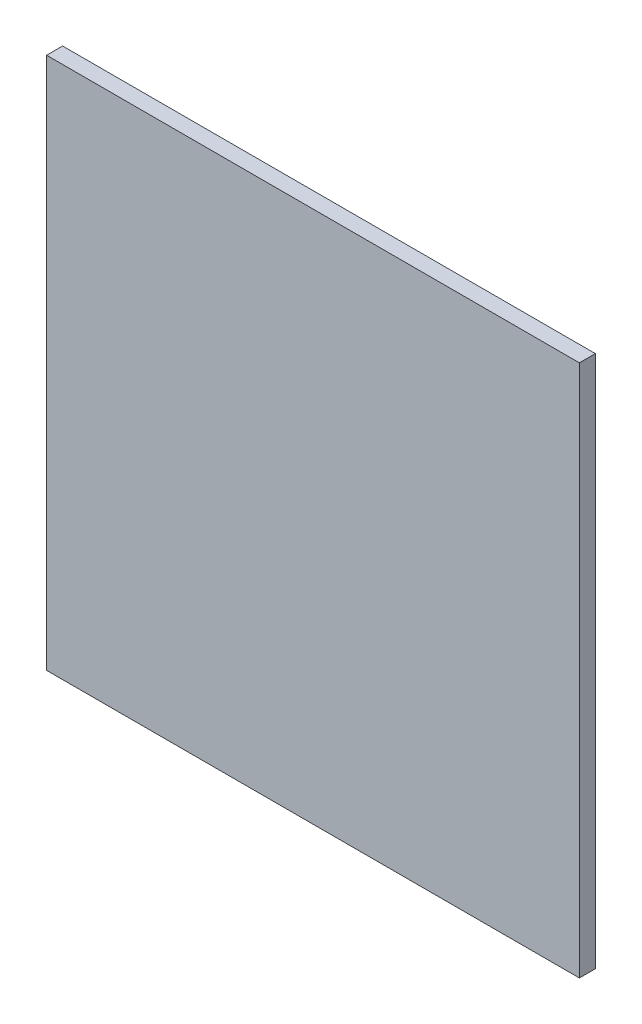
SolidWorks part; units mm, degrees
ref_plane "Alzado" through (0, 0, 0) normal (0, 0, 1) x (1, 0, 0)
ref_plane "Planta" through (0, 0, 0) normal (0, 1, 0) x (1, 0, 0)
ref_plane "Vista lateral" through (0, 0, 0) normal (1, 0, 0) x (0, 0, -1)
sketch "Croquis1" plane through (0, 0, 0) normal (0, 0, 1) x (1, 0, 0)
  line L1 (250, 250) -> (-250, 250)
  line L2 (250, 250) -> (250, -250)
  line L3 (250, -250) -> (-250, -250)
  line L4 (-250, 250) -> (-250, -250)
  line L5 (250, 250) -> (-250, -250) construction
  line L6 (250, -250) -> (-250, 250) construction
  point P0 (0, 0)
  dimension "D1" = 500
  dimension "D2" = 500
extrude "Saliente-Extruir1" add sketch "Croquis1" along normal blind 15
